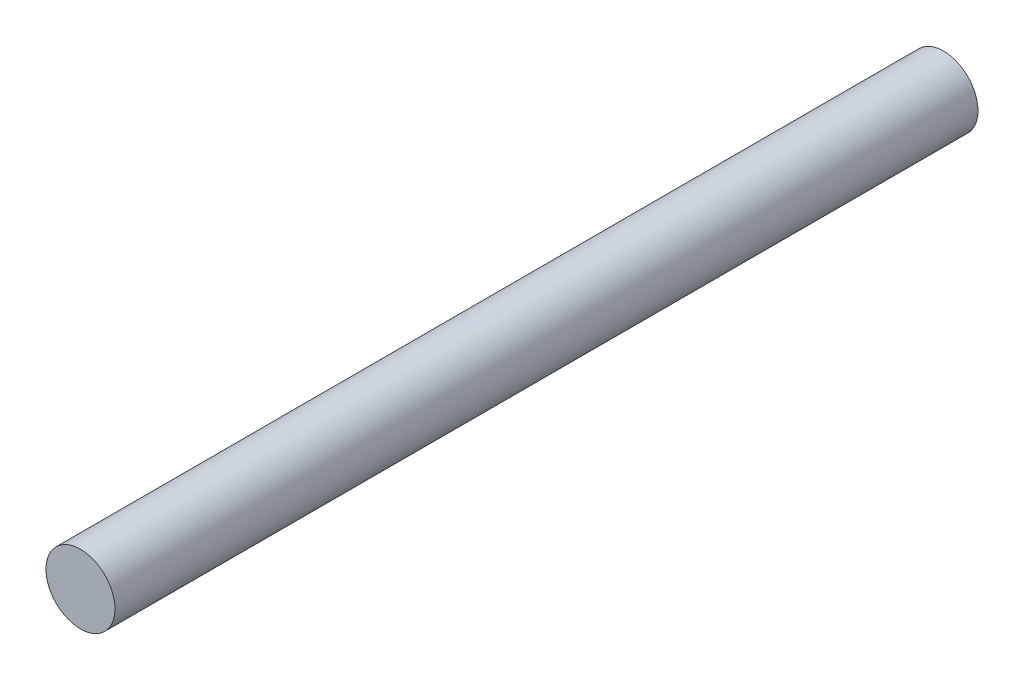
SolidWorks part; units mm, degrees
ref_plane "Front Plane" through (0, 0, 0) normal (0, 0, 1) x (1, 0, 0)
ref_plane "Top Plane" through (0, 0, 0) normal (0, 1, 0) x (1, 0, 0)
ref_plane "Right Plane" through (0, 0, 0) normal (1, 0, 0) x (0, 0, -1)
sketch "Sketch1" plane through (0, 0, 0) normal (0, 0, 1) x (1, 0, 0)
  circle A0 centre (0, 0) radius 30
  dimension "D1" = 60
extrude "Boss-Extrude1" add sketch "Sketch1" against normal blind 750
